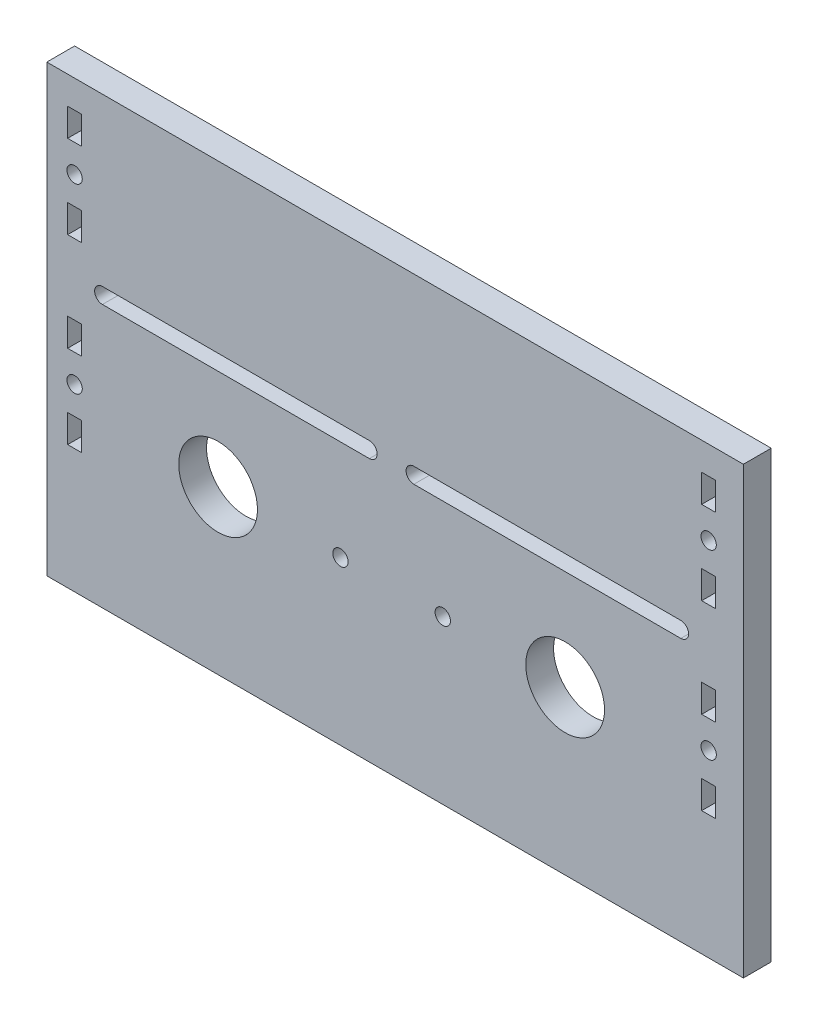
SolidWorks part; units mm, degrees
ref_plane "Front Plane" through (0, 0, 0) normal (0, 0, 1) x (1, 0, 0)
ref_plane "Top Plane" through (0, 0, 0) normal (0, 1, 0) x (1, 0, 0)
ref_plane "Right Plane" through (0, 0, 0) normal (1, 0, 0) x (0, 0, -1)
sketch "Sketch1" plane through (0, 0, 0) normal (0, 0, 1) x (1, 0, 0)
  line L1 (-220.2653, 37.0521) -> (-55.1653, 37.0521)
  line L2 (-220.2653, 37.0521) -> (-220.2653, -64.5479)
  line L3 (-220.2653, -64.5479) -> (-55.1653, -64.5479)
  line L4 (-55.1653, 37.0521) -> (-55.1653, -64.5479)
  dimension "D1" = 165.1
  dimension "D2" = 101.6
extrude "Boss-Extrude1" add sketch "Sketch1" along normal blind 6.35
sketch "Sketch2" plane through (0, 0, 0) normal (0, 0, 1) x (1, 0, 0)
  line L1 (-215.5028, 30.7021) -> (-212.3278, 30.7021)
  line L2 (-215.5028, 30.7021) -> (-215.5028, 24.3521)
  line L3 (-215.5028, 24.3521) -> (-212.3278, 24.3521)
  line L4 (-212.3278, 30.7021) -> (-212.3278, 24.3521)
  line L5 (-215.5028, 11.6521) -> (-212.3278, 11.6521)
  line L6 (-215.5028, 11.6521) -> (-215.5028, 5.3021)
  line L7 (-215.5028, 5.3021) -> (-212.3278, 5.3021)
  line L8 (-212.3278, 11.6521) -> (-212.3278, 5.3021)
  line L9 (-55.1653, 37.0521) -> (-220.2653, 37.0521) construction
  line L10 (-215.5028, -10.8143) -> (-212.3278, -10.8143)
  line L11 (-215.5028, -29.8643) -> (-215.5028, -36.2143)
  line L12 (-215.5028, -17.1643) -> (-212.3278, -17.1643)
  line L13 (-215.5028, -29.8643) -> (-212.3278, -29.8643)
  line L14 (-212.3278, -29.8643) -> (-212.3278, -36.2143)
  line L15 (-212.3278, -10.8143) -> (-212.3278, -17.1643)
  line L16 (-215.5028, -10.8143) -> (-215.5028, -17.1643)
  line L17 (-215.5028, -36.2143) -> (-212.3278, -36.2143)
  line L18 (-207.5653, -0.9781) -> (-146.6053, -0.9781)
  line L19 (-220.2653, 37.0521) -> (-220.2653, -64.5479) construction
  line L20 (-207.5653, -4.5341) -> (-146.6053, -4.5341)
  line L21 (-75.4853, -0.9781) -> (-136.4453, -0.9781)
  line L22 (-75.4853, -4.5341) -> (-136.4453, -4.5341)
  line L28 (-67.5478, 30.7021) -> (-67.5478, 24.3521)
  line L29 (-67.5478, -10.8143) -> (-67.5478, -17.1643)
  line L30 (-70.7228, 11.6521) -> (-67.5478, 11.6521)
  line L31 (-70.7228, -17.1643) -> (-67.5478, -17.1643)
  line L32 (-70.7228, 24.3521) -> (-67.5478, 24.3521)
  line L33 (-70.7228, -10.8143) -> (-70.7228, -17.1643)
  line L35 (-70.7228, -36.2143) -> (-67.5478, -36.2143)
  line L36 (-70.7228, 5.3021) -> (-67.5478, 5.3021)
  line L37 (-70.7228, -29.8643) -> (-67.5478, -29.8643)
  line L38 (-70.7228, 30.7021) -> (-67.5478, 30.7021)
  line L39 (-67.5478, -29.8643) -> (-67.5478, -36.2143)
  line L40 (-70.7228, 11.6521) -> (-70.7228, 5.3021)
  line L41 (-70.7228, -10.8143) -> (-67.5478, -10.8143)
  line L43 (-67.5478, 11.6521) -> (-67.5478, 5.3021)
  line L44 (-70.7228, -29.8643) -> (-70.7228, -36.2143)
  line L45 (-70.7228, 30.7021) -> (-70.7228, 24.3521)
  circle A0 centre (-213.9153, 18.0021) radius 1.7526
  circle A1 centre (-213.9153, -23.5143) radius 1.7526
  arc A2 (-146.6053, -4.5341) -> (-146.6053, -0.9781) centre (-146.6053, -2.7561) ccw
  arc A3 (-75.4853, -4.5341) -> (-75.4853, -0.9781) centre (-75.4853, -2.7561) ccw
  arc A4 (-136.4453, -0.9781) -> (-136.4453, -4.5341) centre (-136.4453, -2.7561) ccw
  circle A5 centre (-153.2093, -27.3941) radius 1.7526
  circle A6 centre (-69.1353, -23.5143) radius 1.7526
  circle A7 centre (-69.1353, 18.0021) radius 1.7526
  arc A8 (-207.5653, -0.9781) -> (-207.5653, -4.5341) centre (-207.5653, -2.7561) ccw
  circle A9 centre (-129.8413, -27.3941) radius 1.7526
  circle A10 centre (-181.1493, -27.3941) radius 8.9916
  circle A11 centre (-101.9013, -27.3941) radius 8.9916
  dimension "D1" = 3.5052
  dimension "D6" = 3.5052
  dimension "D10" = 3.556
  dimension "D12" = 3.556
  dimension "D11" = 3.556
  dimension "D14" = 3.5052
  dimension "D16" = 6.35
  dimension "D20" = 60.96
  dimension "D18" = 3.556
  dimension "D15" = 17.9832
  dimension "D2" = 3.175
  dimension "D3" = 6.35
  dimension "D4" = 12.7
  dimension "D5" = 6.35
  dimension "D7" = 3.175
  dimension "D8" = 6.35
  dimension "D9" = 12.7
  dimension "D13" = 60.96
  dimension "D17" = 6.35
  dimension "D19" = 10.16
  dimension "D21" = 27.94
  dimension "D22" = 27.94
extrude "Cut-Extrude2" cut sketch "Sketch2" along normal blind 18.796
sketch "Sketch3" plane through (0, 0, 0) normal (0, 0, 1) x (1, 0, 0)
  line L0 (-61.1978, 37.0521) -> (-61.1978, -64.5479)
  line L1 (-55.1653, 37.0521) -> (-220.2653, 37.0521) construction
  line L2 (-220.2653, -64.5479) -> (-55.1653, -64.5479) construction
  line L3 (-61.1978, -64.5479) -> (-55.1653, -64.5479)
  line L4 (-55.1653, -64.5479) -> (-55.1653, 37.0521)
  line L5 (-55.1653, 37.0521) -> (-61.1978, 37.0521)
  line L6 (-67.5478, 30.7021) -> (-67.5478, 24.3521) construction
  point P6 (-67.5478, 27.5271)
  dimension "D1" = 6.35
extrude "Cut-Extrude3" cut sketch "Sketch3" along normal blind 18.542
scale "Scale1" scale about centroid uniform scaling yes scale factor 0.5
